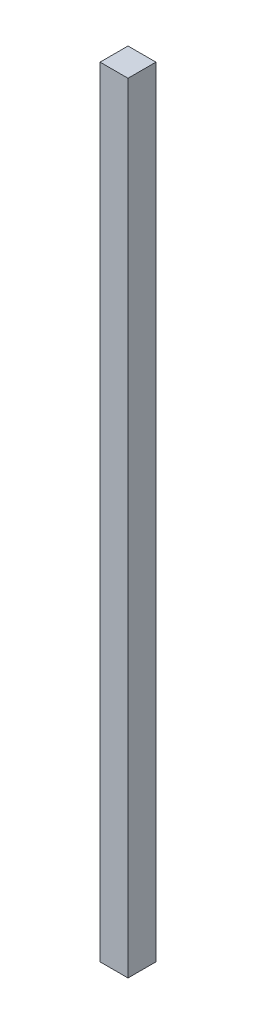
SolidWorks part; units mm, degrees
ref_plane "Plan de face" through (0, 0, 0) normal (0, 0, 1) x (1, 0, 0)
ref_plane "Plan de dessus" through (0, 0, 0) normal (0, 1, 0) x (1, 0, 0)
ref_plane "Plan de droite" through (0, 0, 0) normal (1, 0, 0) x (0, 0, -1)
sketch "Esquisse1" plane through (0, 0, 0) normal (0, 0, 1) x (1, 0, 0)
  line L1 (0, 0) -> (24, 0)
  line L2 (0, 0) -> (0, 670)
  line L3 (0, 670) -> (24, 670)
  line L4 (24, 0) -> (24, 670)
  dimension "D1" = 670
  dimension "D2" = 24
extrude "Extrusion1" add sketch "Esquisse1" along normal blind 24
